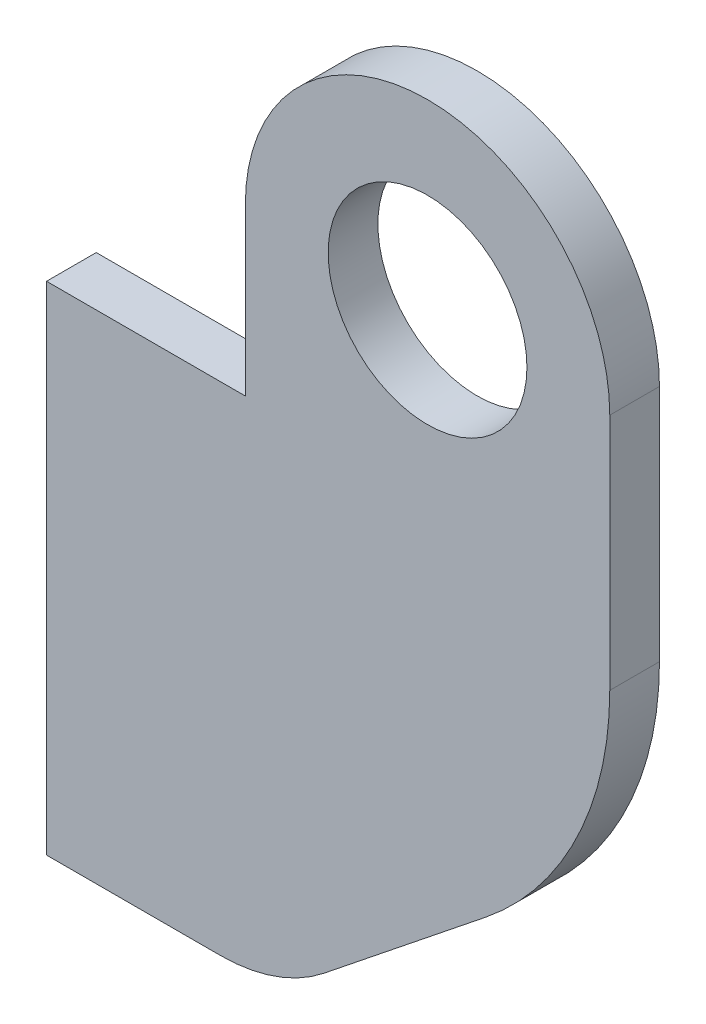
SolidWorks part; units mm, degrees
ref_plane "Front Plane" through (0, 0, 0) normal (0, 0, 1) x (1, 0, 0)
ref_plane "Top Plane" through (0, 0, 0) normal (0, 1, 0) x (1, 0, 0)
ref_plane "Right Plane" through (0, 0, 0) normal (1, 0, 0) x (0, 0, -1)
sketch "Sketch1" plane through (0, 0, 0) normal (0, 0, 1) x (1, 0, 0)
  line L0 (0, 0) -> (0, -150)
  line L1 (0, -150) -> (70, -150)
  line L2 (70, -150) -> (170, -70)
  line L3 (170, -70) -> (170, 50)
  line L4 (60, 50) -> (170, 50) construction
  line L5 (60, 50) -> (60, 0)
  line L6 (60, 0) -> (0, 0)
  circle A0 centre (115, 50) radius 30
  arc A1 (170, 50) -> (60, 50) centre (115, 50) ccw
  dimension "D7" = 60
  dimension "D1" = 60
  dimension "D2" = 150
  dimension "D3" = 70
  dimension "D4" = 50
  dimension "D5" = 80
  dimension "D6" = 170
extrude "Boss-Extrude1" add sketch "Sketch1" along normal mid plane 15
fillet "Fillet1" radius 100 1 edges at (170, -70, 0)
fillet "Fillet2" radius 50 1 edges at (70, -150, 0)
